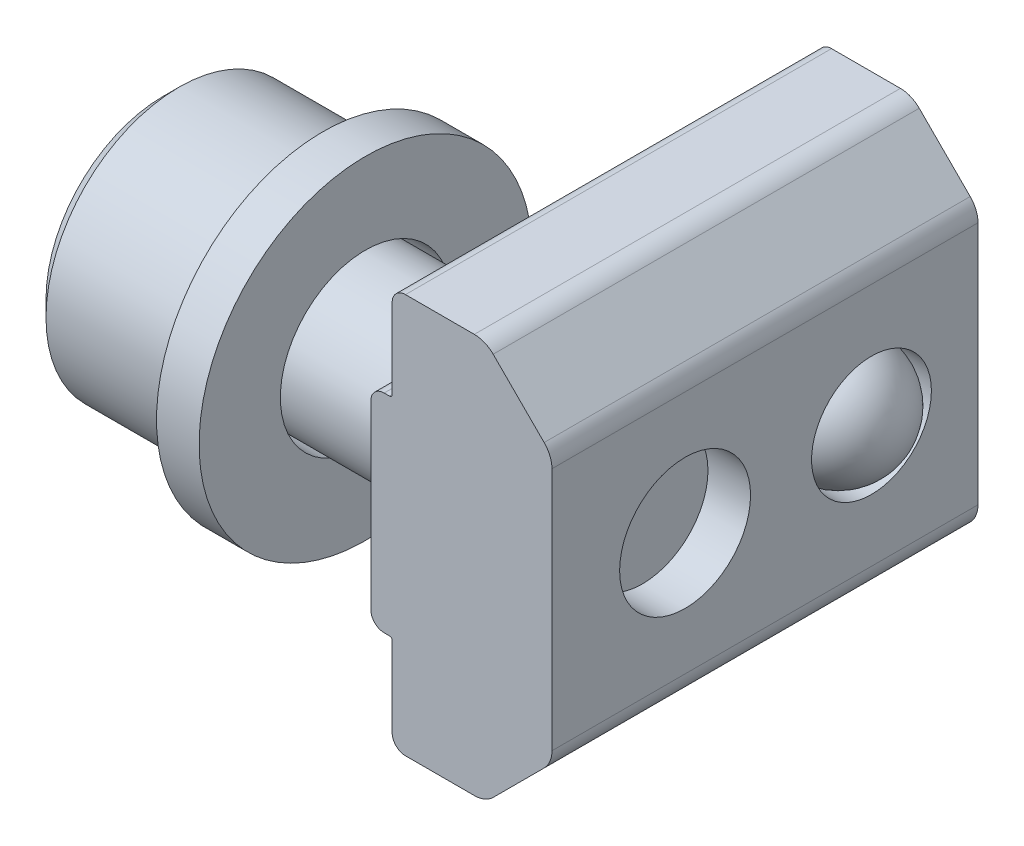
SolidWorks part; units mm, degrees
ref_plane "Front Plane" through (0, 0, 0) normal (0, 0, 1) x (1, 0, 0)
ref_plane "Top Plane" through (0, 0, 0) normal (0, 1, 0) x (1, 0, 0)
ref_plane "Right Plane" through (0, 0, 0) normal (1, 0, 0) x (0, 0, -1)
ref_plane "Plane1" through (3, 0, 0) normal (1, 0, 0) x (0, 0, -1)
sketch "Sketch1" plane through (0, 0, 0) normal (0, 0, 1) x (1, 0, 0)
  line L0 (-4.6, 2.5) -> (-3.1566, 0)
  line L1 (10.4, 0) -> (10.4, 3)
  line L2 (10.4, 3) -> (-1.6, 3)
  line L3 (10.4, 3) -> (10.4, -3) construction
  line L4 (-1.6, 5) -> (-7, 5)
  line L5 (-7, 5) -> (-7.6, 4.4)
  line L6 (-7.6, 4.4) -> (-7.6, 2.5)
  line L7 (-3.1566, 0) -> (10.4, 0) construction
  line L8 (-4.6, 2.5) -> (-7.6, 2.5)
  line L9 (-3.1566, 0) -> (10.4, 0)
  line L10 (-1.6, 5) -> (-1.6, -5) construction
  line L11 (-7.6, 4.4) -> (-7.6, 5) construction
  line L12 (-7, 5) -> (-7.6, 5) construction
  line L13 (-1.6, 5) -> (-1.6, 3)
  line L14 (-3.1566, 0) -> (-4.6, -2.5) construction
  line L15 (9.4875, 0) -> (-9.4875, 0) construction
  line L16 (0, -8.25) -> (0, 8.25) construction
  point P0 (-1.6, 0)
  dimension "FIX_1" = 12
  dimension "FIX_2" = 6
  dimension "FIX_3" = 10
  dimension "FIX_4" = 1.6
  dimension "FIX_5" = 5
  dimension "FIX_6" = 3
  dimension "FIX_7" = 0.6
  dimension "FIX_8" = 120
revolve "Revolve1" add sketch "Sketch1" angle 360 about L9
sketch "Sketch2" plane through (-7.6, 0, 0) normal (-1, 0, 0) x (0, 0, 1)
  line L1 (0, 2.8868) -> (-2.5, 1.4434)
  line L2 (-2.5, 1.4434) -> (-2.5, -1.4434)
  line L3 (-2.5, -1.4434) -> (0, -2.8868)
  line L4 (0, -2.8868) -> (2.5, -1.4434)
  line L5 (2.5, -1.4434) -> (2.5, 1.4434)
  line L6 (2.5, 1.4434) -> (0, 2.8868)
  circle A0 centre (0, 0) radius 2.5 construction
extrude "Cut-Extrude1" cut sketch "Sketch2" against normal up to vertex (3 mm away)
sketch "Sketch3" plane through (0, 0, 0) normal (1, 0, 0) x (0, 0, -1)
  circle A0 centre (0, 0) radius 6.25
  circle A1 centre (0, 0) radius 3.2
  dimension "FIX_10" = 6.4
  dimension "FIX_11" = 12.5
extrude "Boss-Extrude1" add sketch "Sketch3" against normal up to vertex (1.6 mm away) separate body
sketch "Sketch4" plane through (0, 0, 0) normal (0, 0, 1) x (1, 0, 0)
  line L0 (12, 0) -> (0, 0) construction
  line L1 (9.7929, 7.2071) -> (9.5, 7.5) construction
  line L2 (11.7071, 5.2929) -> (12, 5) construction
  line L3 (11.7071, -5.2929) -> (12, -5) construction
  line L4 (12, 5) -> (12, -5) construction
  line L5 (9.0858, 7.5) -> (9.5, 7.5) construction
  line L7 (3, -8.25) -> (3, 8.25) construction
  line L11 (11.7071, 5.2929) -> (9.7929, 7.2071)
  line L12 (9.0858, 7.5) -> (6.5, 7.5)
  line L13 (6, 7) -> (6, 4)
  line L14 (5.9, 3.9) -> (5.7, 3.9)
  line L15 (5.2, 3.4) -> (5.2, -3.4)
  line L16 (5.7, -3.9) -> (5.9, -3.9)
  line L17 (6, -4) -> (6, -7)
  line L18 (6.5, -7.5) -> (9.0858, -7.5)
  line L19 (9.7929, -7.2071) -> (11.7071, -5.2929)
  line L20 (12, -4.5858) -> (12, 4.5858)
  arc A6 (12, 4.5858) -> (11.7071, 5.2929) centre (11, 4.5858) ccw
  arc A7 (9.7929, 7.2071) -> (9.0858, 7.5) centre (9.0858, 6.5) ccw
  arc A8 (6.5, 7.5) -> (6, 7) centre (6.5, 7) ccw
  arc A9 (5.9, 3.9) -> (6, 4) centre (5.9, 4) ccw
  arc A10 (5.7, 3.9) -> (5.2, 3.4) centre (5.7, 3.4) ccw
  arc A11 (5.2, -3.4) -> (5.7, -3.9) centre (5.7, -3.4) ccw
  arc A12 (6, -4) -> (5.9, -3.9) centre (5.9, -4) ccw
  arc A13 (6, -7) -> (6.5, -7.5) centre (6.5, -7) ccw
  arc A14 (9.0858, -7.5) -> (9.7929, -7.2071) centre (9.0858, -6.5) ccw
  arc A15 (11.7071, -5.2929) -> (12, -4.5858) centre (11, -4.5858) ccw
  point P2 (5.2, 0)
  dimension "FIX_17" = 0.5
  dimension "FIX_18" = 0.1
  dimension "FIX_19" = 1
  dimension "FIX_12" = 10
  dimension "FIX_13" = 7.8
  dimension "FIX_14" = 0.8
  dimension "FIX_15" = 6
  dimension "FIX_16" = 15
  dimension "FIX_20" = 3.5
  dimension "FIX_21" = 3
extrude "Boss-Extrude2" add sketch "Sketch4" against normal blind 16 from offset 5 separate body
sketch "Sketch5" plane through (0, 0, -7) normal (0, 1, 0) x (1, 0, 0)
  line L0 (12, 2.25) -> (12, -2.25) construction
  line L4 (12, 0) -> (10.75, 0)
  line L5 (12, 0) -> (12, 2.25)
  line L6 (12, 2.25) -> (10.75, 2.25)
  line L7 (10.75, 0) -> (10.75, 2.25)
  line L10 (-6.875, -7) -> (6.875, -7) construction
  dimension "FIX_24" = 1.25
  dimension "FIX_26" = 7
  dimension "FIX_25" = 4.5
revolve "Cut-Revolve1" cut sketch "Sketch5" angle 360 about L4
sketch "Sketch6" plane through (0, 0, -7) normal (0, 1, 0) x (1, 0, 0)
  line L1 (10.75, -2.25) -> (10.75, 2.25) construction
  line L2 (10.75, 0) -> (10.75, 2.25)
  line L3 (10.75, 0) -> (13, 0)
  line L4 (10.75, 0) -> (10.75, 2.25) construction
  line L5 (10.75, 2.25) -> (12, 2.25) construction
  arc A0 (13, 0) -> (10.75, 2.25) centre (10.75, 0) ccw
  dimension "FIX_29" = 4.5
  dimension "FIX_28" = 1.25
revolve "Revolve2" add sketch "Sketch6" angle 360 about L3
hole_wizard "Tap1" positions "Sketch7" profile "Sketch8" hole size "M6x1.0" standard "JIS"
sketch "Sketch7" plane through (5.2, 0, 0) normal (-1, 0, 0) x (0, 0, 1)
  point P0 (0, 0)
sketch "Sketch8" plane through (5.2, 0, 0) normal (0, 1, 0) x (0, 0, 1)
  line L0 (0, 0) -> (0, 7.8)
  line L1 (0, 7.8) -> (2.4585, 7.8)
  line L2 (2.4585, 7.8) -> (2.4585, 0)
  line L5 (2.4585, 0) -> (0, 0)
  line L11 (0, 0) -> (0, 7.8) construction
  dimension "Thru Hole Depth" = 7.8
equation "\"Factor\"= 1.082532"
equation "\"M\"= 6"
equation "\"Pitch\"= 1"
equation "\"HSD_1\"= round ( \"M\" - \"Factor\" * \"Pitch\" , 3 )"
equation "\"HTD_1\"= \"M\""
equation "\"ASD_1\"= \"M\""
equation "\"ATD_1\"= round ( \"M\" - \"Factor\" * \"Pitch\" , 3 )"
